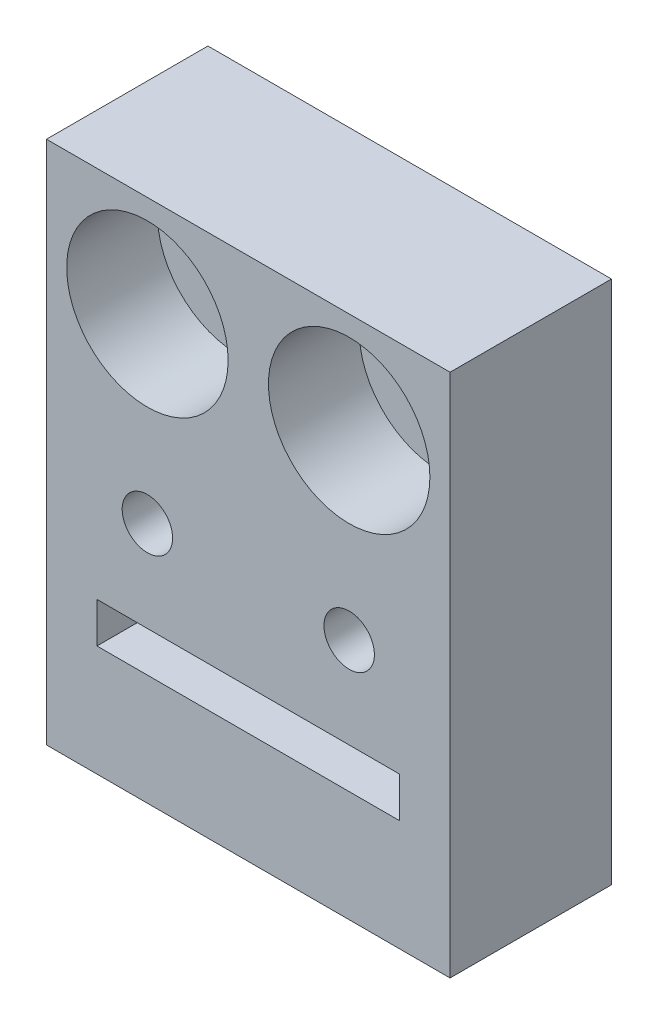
SolidWorks part; units mm, degrees
ref_plane "前视基准面" through (0, 0, 0) normal (0, 0, 1) x (1, 0, 0)
ref_plane "上视基准面" through (0, 0, 0) normal (0, 1, 0) x (1, 0, 0)
ref_plane "右视基准面" through (0, 0, 0) normal (1, 0, 0) x (0, 0, -1)
sketch "草图1" plane through (0, 0, 0) normal (0, 0, 1) x (1, 0, 0)
  line L0 (20, -26) -> (20, 0)
  line L1 (0, -26) -> (0, 0)
  line L2 (0, 0) -> (20, 0)
  line L3 (0, -26) -> (20, -26)
  line L4 (2.5, -18.5) -> (17.5, -18.5)
  line L5 (2.5, -20.5) -> (17.5, -20.5)
  line L6 (2.5, -20.5) -> (2.5, -18.5)
  line L7 (17.5, -20.5) -> (17.5, -18.5)
  circle A0 centre (5, -5) radius 2.25
  circle A1 centre (15, -5) radius 2.25
  circle A2 centre (5, -14) radius 1.25
  circle A3 centre (15, -14) radius 1.25
extrude "凸台-拉伸1" add sketch "草图1" along normal blind 8
sketch "草图2" plane through (0, 0, 8) normal (0, 0, 1) x (1, 0, 0)
  circle A0 centre (5, -5) radius 4
  circle A1 centre (15, -5) radius 4
extrude "切除-拉伸1" cut sketch "草图2" against normal blind 4.5
